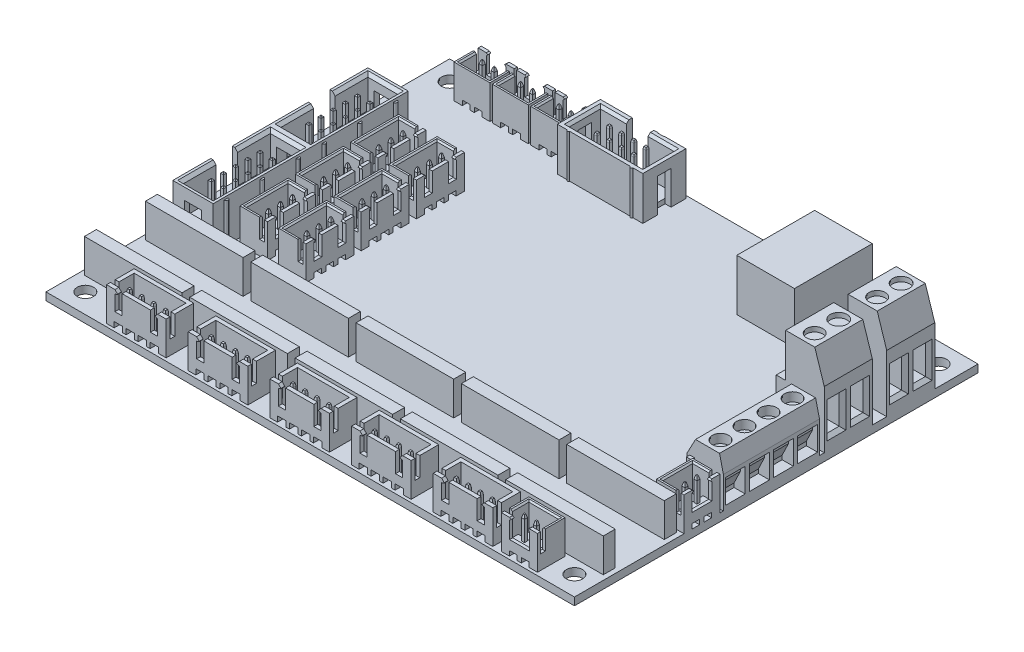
SolidWorks part; units mm, degrees
other "<IDC Socket Male 10pin>-<Surface-Knit2>"
other "<User Library-8 pin IDC shrouded header V2>-<Sfazowanie5>"
other "<jst-b4b-xh-a-1>-<Pin 1 for .95mm dia. hole>"
other "<PW10-XX-M green_>-<Вытянуть19>"
other "<PW10-XX-M green_>-<Вытянуть19>"
other "<PW10-XX-M green_>-<Вытянуть18>"
other "<WJ129-2>-<\\X2\\04220432043504400434043E0435\\X0\\ \\X2\\0442 0435043B043E\\X0\\1>"
other "<DG306-5_0>-<Скругление1>"
other "<DG306-5_0>-<Скругление1>"
other "<USBPort>-<Boss-Extrude13>"
ref_plane "Front Plane" through (0, 0, 0) normal (0, 0, 1) x (1, 0, 0)
ref_plane "Top Plane" through (0, 0, 0) normal (0, 1, 0) x (1, 0, 0)
ref_plane "Right Plane" through (0, 0, 0) normal (1, 0, 0) x (0, 0, -1)
sketch "Sketch1" plane through (0, 0, 0) normal (0, 1, 0) x (1, 0, 0)
  line L1 (-55, -42) -> (55, -42)
  line L2 (-55, -42) -> (-55, 42)
  line L3 (-55, 42) -> (55, 42)
  line L4 (55, -42) -> (55, 42)
  line L5 (-55, -42) -> (55, 42) construction
  line L6 (-55, 42) -> (55, -42) construction
  point P0 (0, 0)
  dimension "D1" = 110
  dimension "D2" = 84
extrude "Boss-Extrude1" add sketch "Sketch1" against normal blind 1.6
inserted part "IDC Socket Male 10pin"
move or copy body "Body-Move/Copy2" placed by mates yes
other "Distance1" parameters "D1"=2
other "Distance2" parameters "D1"=19
move or copy body "Body-Move/Copy3" bodies to move or copy 102 copy yes number of copies 1 translate (0, 0, 20.3)
inserted part "User Library-8 pin IDC shrouded header V2"
move or copy body "Body-Move/Copy5" placed by mates yes
other "Distance3" parameters "D1"=0.6
other "Distance4" parameters "D1"=32
inserted part "jst-b4b-xh-a-1"
move or copy body "Body-Move/Copy7" placed by mates yes
other "Distance5" parameters "D1"=0.6
other "Distance6" parameters "D1"=12
pattern_linear "LPattern1" count 5 spacing 17 along (1, 0, 0)
inserted part "PW10-XX-M green_"
move or copy body "Body-Move/Copy11" placed by mates yes
other "Distance8" parameters "D1"=8.3
inserted part "PW10-XX-M green_4"
move or copy body "Body-Move/Copy13" placed by mates yes
other "Distance9" parameters "D1"=1.4
other "Distance10" parameters "D1"=0.5
pattern_linear "LPattern2" count 3 spacing 8 along (-1, 0, 0)
inserted part "PW10-XX-M green_5"
move or copy body "Body-Move/Copy15" placed by mates yes
other "Distance11" parameters "D1"=15.4
other "Distance12" parameters "D1"=55.3
pattern_linear "LPattern3" count 3 spacing 11.5 along (0, 0, -1) count 2 spacing 8 along (1, 0, 0)
inserted part "WJ129-2"
move or copy body "Body-Move/Copy17" placed by mates yes
other "Distance13" parameters "D1"=9
move or copy body "Body-Move/Copy18" bodies to move or copy 124 copy yes number of copies 1 translate (0, 0, 0)
move or copy body "Body-Move/Copy19" bodies to move or copy 125 placed by mates yes
other "Distance15" parameters "D1"=32
inserted part "DG306-5_0"
move or copy body "Body-Move/Copy21" placed by mates yes
other "Distance16" parameters "D1"=53
inserted part "DG306-5_03"
move or copy body "Body-Move/Copy23" placed by mates yes
move or copy body "Body-Move/Copy24" bodies to move or copy 112 copy yes number of copies 1 translate (0, 0, 0)
move or copy body "Body-Move/Copy25" bodies to move or copy 112 placed by mates yes
inserted part "USBPort"
move or copy body "Body-Move/Copy27" placed by mates yes
other "Distance17" parameters "D1"=22
hole_wizard "M3 Clearance Hole1" positions "Sketch2" profile "Sketch3" hole size "M3" standard "ANSI Metric"
sketch "Sketch2" plane through (0, 0, 0) normal (0, 1, 0) x (1, 0, 0)
  line L0 (-50.9, 37.9) -> (50.9, 37.9) construction
  line L1 (50.9, 37.9) -> (50.9, -37.9) construction
  line L3 (-55, 42) -> (-55, -42) construction
  line L4 (55, 42) -> (-55, 42) construction
  point P0 (50.9, 37.9)
  point P2 (-50.9, 37.9)
  point P4 (-50.9, -37.9)
  point P6 (50.9, -37.9)
  point P15 (50.9, 0)
  point P18 (-55, 0)
  point P19 (0, 37.9)
  point P22 (0, 42)
  dimension "D1" = 4.1
  dimension "D2" = 4.1
sketch "Sketch3" plane through (50.9, 0, -37.9) normal (1, 0, 0) x (0, 0, 1)
  line L0 (0, 0) -> (0, 1.6)
  line L1 (0, 1.6) -> (1.7, 1.6)
  line L2 (1.7, 1.6) -> (1.7, 0)
  line L5 (1.7, 0) -> (0, 0)
  line L11 (0, -6.35) -> (0, 107.95) construction
  dimension "Thru Hole Dia." = 3.4
  dimension "Thru Hole Depth" = 1.6
combine bodies "Combine2" operation type add bodies to combine 149 145 124 126 142 141 104 102 103
combine bodies "Combine4" operation type add bodies to combine 146 113 114 115 121 118 120 117 119 116 105 106 107 108 109 143 144
sketch "Эскиз1" plane through (0, 0, 0) normal (0, 1, 0) x (1, 0, 0)
  line L0 (-55, -42) -> (55, -42) construction
  line L1 (54, -35) -> (33.68, -35)
  line L2 (54, -35) -> (54, -32.51)
  line L3 (54, -32.51) -> (33.68, -32.51)
  line L4 (33.68, -35) -> (33.68, -32.51)
  line L5 (54, -22.3) -> (33.68, -22.3)
  line L6 (54, -22.3) -> (54, -19.81)
  line L7 (54, -19.81) -> (33.68, -19.81)
  line L8 (33.68, -22.3) -> (33.68, -19.81)
  line L9 (55, -42) -> (55, -19.2) construction
  line L10 (32.08, -19.81) -> (11.76, -19.81)
  line L11 (11.76, -22.3) -> (11.76, -19.81)
  line L12 (32.08, -22.3) -> (11.76, -22.3)
  line L13 (32.08, -22.3) -> (32.08, -19.81)
  line L14 (32.08, -35) -> (32.08, -32.51)
  line L15 (32.08, -32.51) -> (11.76, -32.51)
  line L16 (32.08, -35) -> (11.76, -35)
  line L17 (11.76, -35) -> (11.76, -32.51)
  line L18 (10.16, -19.81) -> (-10.16, -19.81)
  line L19 (-10.16, -22.3) -> (-10.16, -19.81)
  line L20 (10.16, -22.3) -> (-10.16, -22.3)
  line L21 (10.16, -22.3) -> (10.16, -19.81)
  line L22 (10.16, -35) -> (10.16, -32.51)
  line L23 (10.16, -32.51) -> (-10.16, -32.51)
  line L24 (10.16, -35) -> (-10.16, -35)
  line L25 (-10.16, -35) -> (-10.16, -32.51)
  line L26 (-11.76, -19.81) -> (-32.08, -19.81)
  line L27 (-32.08, -22.3) -> (-32.08, -19.81)
  line L28 (-11.76, -22.3) -> (-32.08, -22.3)
  line L29 (-11.76, -22.3) -> (-11.76, -19.81)
  line L30 (-11.76, -35) -> (-11.76, -32.51)
  line L31 (-11.76, -32.51) -> (-32.08, -32.51)
  line L32 (-11.76, -35) -> (-32.08, -35)
  line L33 (-32.08, -35) -> (-32.08, -32.51)
  line L34 (-33.68, -19.81) -> (-54, -19.81)
  line L35 (-54, -22.3) -> (-54, -19.81)
  line L36 (-33.68, -22.3) -> (-54, -22.3)
  line L37 (-33.68, -22.3) -> (-33.68, -19.81)
  line L38 (-33.68, -35) -> (-33.68, -32.51)
  line L39 (-33.68, -32.51) -> (-54, -32.51)
  line L40 (-33.68, -35) -> (-54, -35)
  line L41 (-54, -35) -> (-54, -32.51)
  line L42 (-55, 42) -> (-55, -42) construction
  point P12 (54, -33.755)
  dimension "D1" = 20.32
  dimension "D2" = 2.49
  dimension "D3" = 15.19
  dimension "D4" = 7
  dimension "D5" = 1
  dimension "D7" = 1
  dimension "D6" = 5
extrude "Бобышка-Вытянуть1" add sketch "Эскиз1" along normal blind 7
